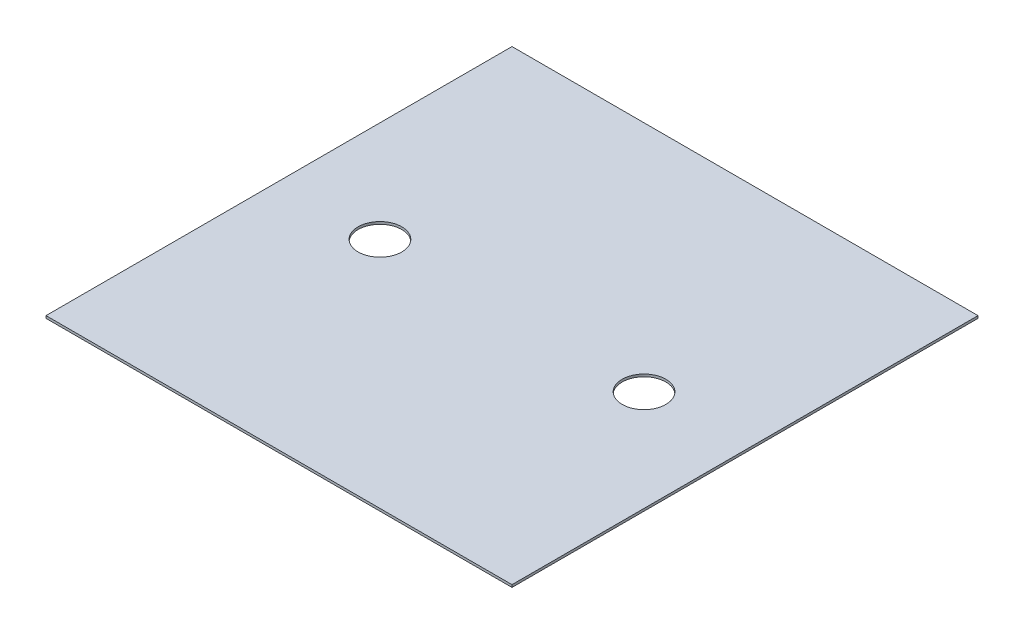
SolidWorks part; units mm, degrees
ref_plane "Front Plane" through (0, 0, 0) normal (0, 0, 1) x (1, 0, 0)
ref_plane "Top Plane" through (0, 0, 0) normal (0, 1, 0) x (1, 0, 0)
ref_plane "Right Plane" through (0, 0, 0) normal (1, 0, 0) x (0, 0, -1)
sketch "Sketch1" plane through (0, 0, 0) normal (0, 1, 0) x (1, 0, 0)
  line L1 (-76.2, 76.2) -> (76.2, 76.2)
  line L2 (-76.2, 76.2) -> (-76.2, -76.2)
  line L3 (-76.2, -76.2) -> (76.2, -76.2)
  line L4 (76.2, 76.2) -> (76.2, -76.2)
  point P4 (0, 76.2)
  point P6 (-76.2, 0)
  dimension "D1" = 152.4
  dimension "D2" = 152.4
extrude "Boss-Extrude1" add sketch "Sketch1" along normal blind 0.7937
sketch "Sketch2" plane through (0, 0, 0) normal (0, 1, 0) x (1, 0, 0)
  circle A0 centre (-43.18, 0) radius 7.1437
  circle A1 centre (43.18, 0) radius 7.1437
  dimension "D3" = 14.2875
  dimension "D4" = 14.2875
  dimension "D1" = 43.18
  dimension "D2" = 43.18
extrude "Cut-Extrude1" cut sketch "Sketch2" along normal blind 25.4
